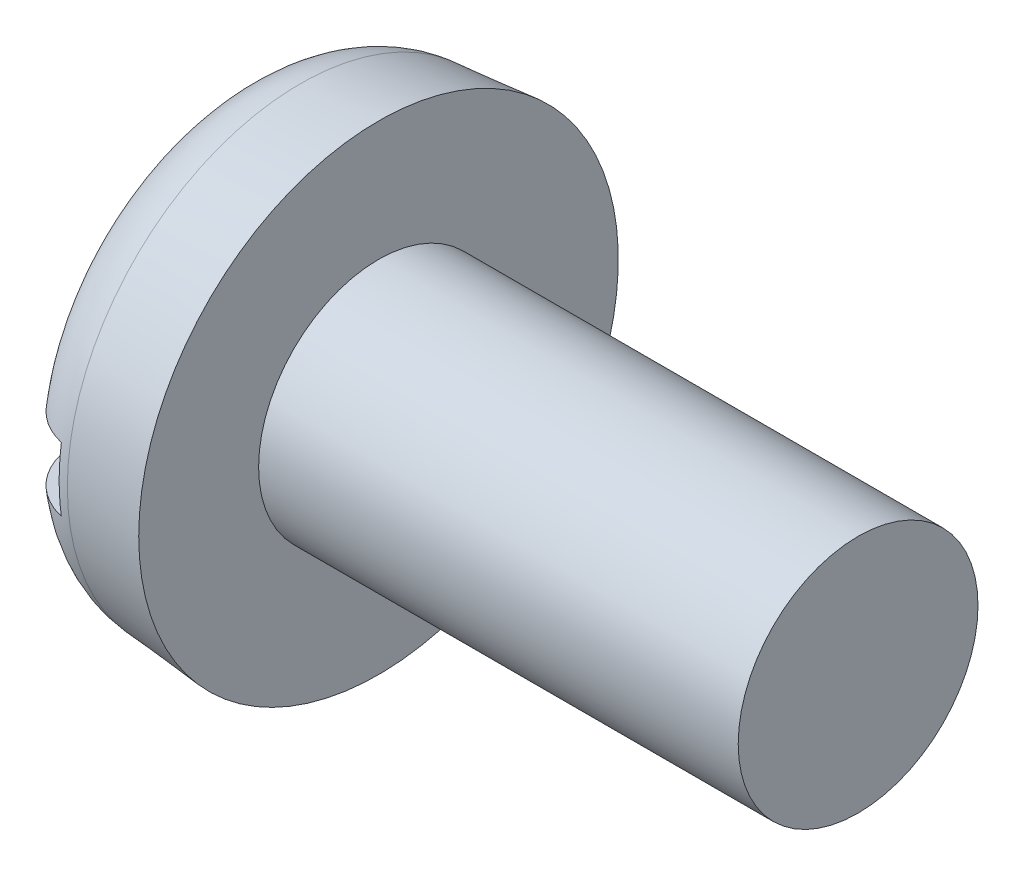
SolidWorks part; units mm, degrees
ref_plane "Plane1" through (0, 0, 0) normal (0, 0, 1) x (1, 0, 0)
ref_plane "Plane2" through (0, 0, 0) normal (0, 1, 0) x (1, 0, 0)
ref_plane "Plane3" through (0, 0, 0) normal (1, 0, 0) x (0, 0, -1)
sketch "BodySke" plane through (0, 0, 0) normal (0, 0, 1) x (1, 0, 0)
  line L0 (3.6, 3) -> (3.6, 6)
  line L1 (0, 0) -> (0, 5.685)
  line L2 (-25.4, 0) -> (127, 0) construction
  line L3 (15.6, 0) -> (0, 0)
  line L4 (3.6, 3) -> (15.6, 3)
  line L5 (15.6, 3) -> (15.6, 0)
  line L6 (0, 5.685) -> (3.6, 6)
  line L9 (4.6, 4.5875) -> (4.6, -4.9375) construction
  line L10 (3.6, 6.35) -> (3.6, -3.175) construction
  dimension "Head_ht" = 3.6
  dimension "Diameter" = 6
  dimension "Length" = 12
  dimension "Head_dia" = 12
  dimension "Advance" = 1
  dimension "Thread_nom" = 12
  dimension "Head_side_angle" = 5
revolve "Base-Revolve" add sketch "BodySke"
fillet "Fillet1" [suppressed] radius 0.25
fillet "Fillet2" radius 1.8 1 edges at (0, 0, 5.685)
sketch "Sketch2" plane through (0, 0, 0) normal (1, 0, 0) x (0, 0, -1)
  line L0 (6, -0.8) -> (-6, -0.8)
  line L1 (6, -0.8) -> (6, 0.8)
  line L2 (-6, 0.8) -> (6, 0.8)
  line L3 (-6, 0.8) -> (-6, -0.8)
  dimension "D1" = 12
  dimension "D2" = 6
  dimension "Slot_width" = 1.6
  dimension "D3" = 0.8
extrude "Slot" cut sketch "Sketch2" along normal blind 1.4
sketch "ThdSchSke" plane through (0, 0, 0) normal (0, 0, 1) x (1, 0, 0)
  line L0 (5.6, -2.4455) -> (5.2117, -3)
  line L1 (5.6, -2.4455) -> (5.9883, -3)
  line L2 (5.9883, -3) -> (5.9883, -3.75)
  line L3 (-3.175, 0) -> (5.1513, 0) construction
  line L5 (5.9883, -3.75) -> (5.2117, -3.75)
  line L6 (5.2117, -3.75) -> (5.2117, -3)
  dimension "Thread_minor" = 4.891
  dimension "Diameter" = 6
  dimension "Start" = 5.6
  dimension "SideAngle" = 55
  dimension "VeeAngle" = 70
  dimension "Overcut" = 7.5
revolve "ThreadSchematic" [suppressed] cut sketch "ThdSchSke" angle 360 about L3
pattern_linear "ThdSchPat" [suppressed]
equation "\"D1@Sketch2\" = \"Head_dia@BodySke\""
equation "\"D2@Sketch2\" = \"D1@Sketch2\" / 2"
equation "\"D3@Sketch2\" = \"Slot_width@Sketch2\" / 2"
equation "\"Thread_length@ThreadCosmetic\" = ((sgn( (\"Length@BodySke\" - \"Advance@BodySke\" * 2.0 ) - \"Thread_nom@BodySke\" )-1)*( (\"Length@BodySke\" - \"Advance@BodySke\"  * 2.0) - \"Thread_nom@BodySke\" ))/-2+ \"Thread_"
equation "\"Thread_minor@ThdSchSke\" = \"Thread_minor@ThreadCosmetic\""
equation "\"Diameter@ThdSchSke\" = \"Diameter@BodySke\""
equation "\"Overcut@ThdSchSke\" = \"Diameter@BodySke\" * 1.25"
equation "\"Start@ThdSchSke\" = \"Head_ht@BodySke\" + \"Length@BodySke\" - \"Thread_length@ThreadCosmetic\"  '---Non-countersunk---"
equation "\"Num_threads@ThdSchPat\" = int( \"Thread_length@ThreadCosmetic\" / \"Advance@BodySke\" + 0.999 )  + 1"
equation "\"Advance@ThdSchPat\" = \"Thread_length@ThreadCosmetic\" /  (\"Num_threads@ThdSchPat\" - 1) 'relax it"
